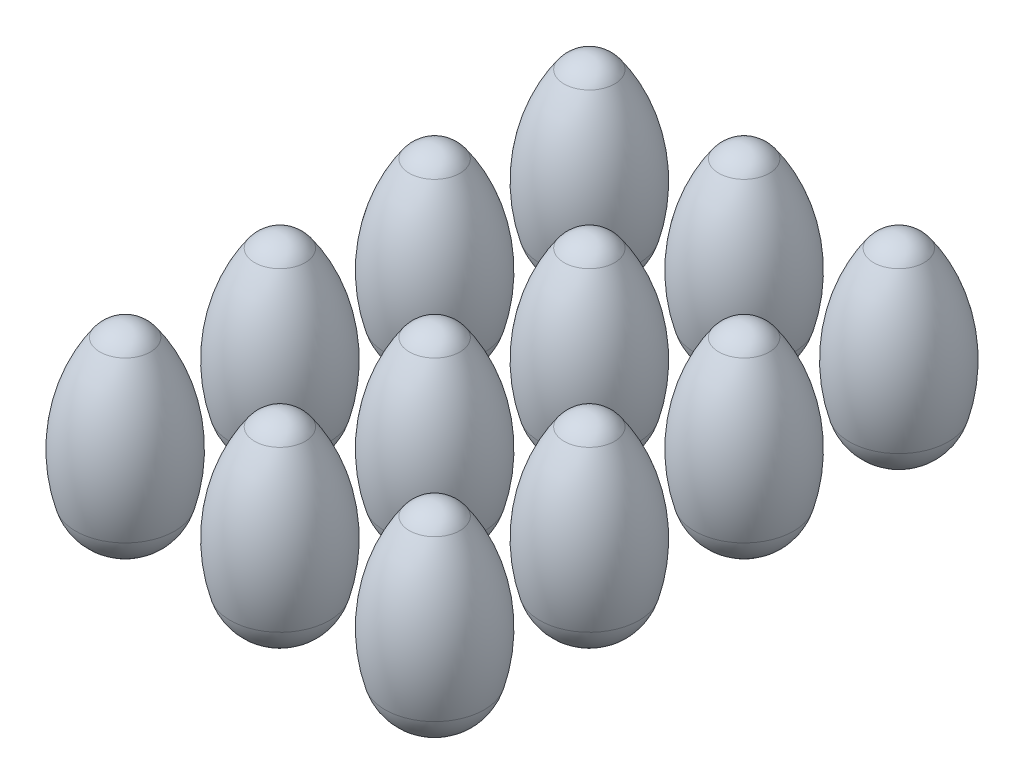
SolidWorks part; units mm, degrees
ref_plane "Front" through (0, 0, 0) normal (0, 0, 1) x (1, 0, 0)
ref_plane "Top" through (0, 0, 0) normal (0, 1, 0) x (1, 0, 0)
ref_plane "Right" through (0, 0, 0) normal (1, 0, 0) x (0, 0, -1)
ref_plane "Plane1" through (0, 0, 75.1895) normal (0, 0, 1) x (1, 0, 0)
sketch "Sketch1" plane through (0, 0, 0) normal (0, 0, 1) x (1, 0, 0)
  line L0 (0, 0) -> (0, 107.4093) construction
  line L1 (0, 75) -> (-21.1951, 75) construction
  line L2 (0, 0) -> (-24.0144, 0) construction
  line L3 (0, 75) -> (0, 0)
  arc A0 (0, 0) -> (19.2278, 14.4961) centre (0, 20) ccw
  arc A1 (19.2278, 14.4961) -> (9.7953, 69.932) centre (-43.2625, 32.3837) ccw
  arc A2 (9.7953, 69.932) -> (0, 75) centre (0, 63) ccw
  dimension "D2" = 12
  dimension "D3" = 65
  dimension "D4" = 20
  dimension "D1" = 75
revolve "Revolve1" add sketch "Sketch1" angle 360 about L0
sketch "Sketch2" plane through (0, 0, 0) normal (0, 1, 0) x (1, 0, 0)
  line L0 (0, 0) -> (0, -48.9255)
  line L1 (0, 0) -> (56.8722, 0)
pattern_linear "LPattern2" count 4 spacing 60 along (0, 0, -1) count 3 spacing 60 along (-1, 0, 0)
ref_plane "Plane2" through (0, 25, 0) normal (0, 1, 0) x (-1, 0, 0)
sketch "Sketch6" plane through (0, 25, 0) normal (0, 1, 0) x (-1, 0, 0)
  line L1 (-20, 47) -> (140, 47)
  line L2 (-40, 27) -> (-40, -203)
  line L3 (-20, -223) -> (140, -223)
  line L4 (160, 27) -> (160, -203)
  arc A0 (140, 47) -> (160, 27) centre (140, 27) cw
  arc A1 (140, -223) -> (160, -203) centre (140, -203) ccw
  arc A2 (-40, -203) -> (-20, -223) centre (-20, -203) ccw
  arc A3 (-20, 47) -> (-40, 27) centre (-20, 27) ccw
  dimension "D1" = 20
  dimension "D2" = 270
  dimension "D3" = 200
  dimension "D4" = 40
  dimension "D5" = 47
extrude "Extrude1" add sketch "Sketch6" against normal blind 3 separate body
